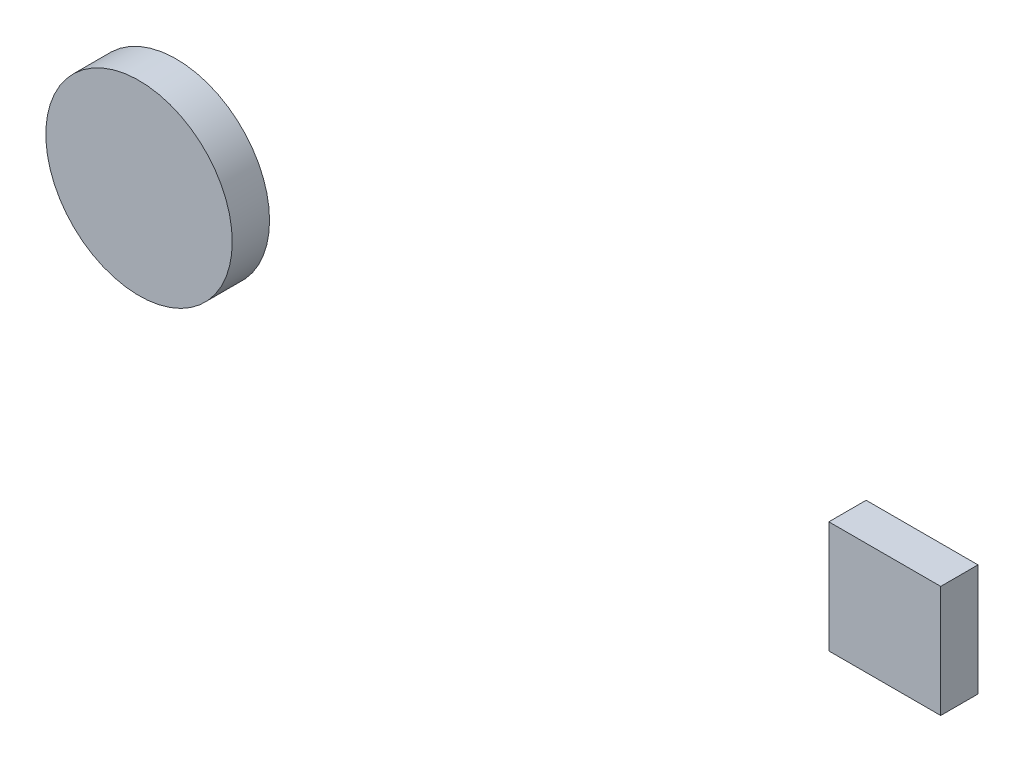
SolidWorks part; units mm, degrees
ref_plane "Front Plane" through (0, 0, 0) normal (0, 0, 1) x (1, 0, 0)
ref_plane "Top Plane" through (0, 0, 0) normal (0, 1, 0) x (1, 0, 0)
ref_plane "Right Plane" through (0, 0, 0) normal (1, 0, 0) x (0, 0, -1)
sketch "Sketch1" plane through (0, 0, 0) normal (0, 0, 1) x (1, 0, 0)
  circle A0 centre (0, 0) radius 25
  dimension "D1" = 50
extrude "Boss-Extrude1" add sketch "Sketch1" along normal blind 10
sketch "Sketch2" plane through (0, 0, 0) normal (0, 0, 1) x (1, 0, 0)
  line L1 (215, -15) -> (185, -15)
  line L2 (215, -15) -> (215, 15)
  line L3 (215, 15) -> (185, 15)
  line L4 (185, -15) -> (185, 15)
  line L5 (215, -15) -> (185, 15) construction
  line L6 (215, 15) -> (185, -15) construction
  point P0 (200, 0)
  point P5 (0, 0)
  dimension "D1" = 30
  dimension "D2" = 30
  dimension "D3" = 200
extrude "Boss-Extrude2" add sketch "Sketch2" along normal blind 10 separate body
